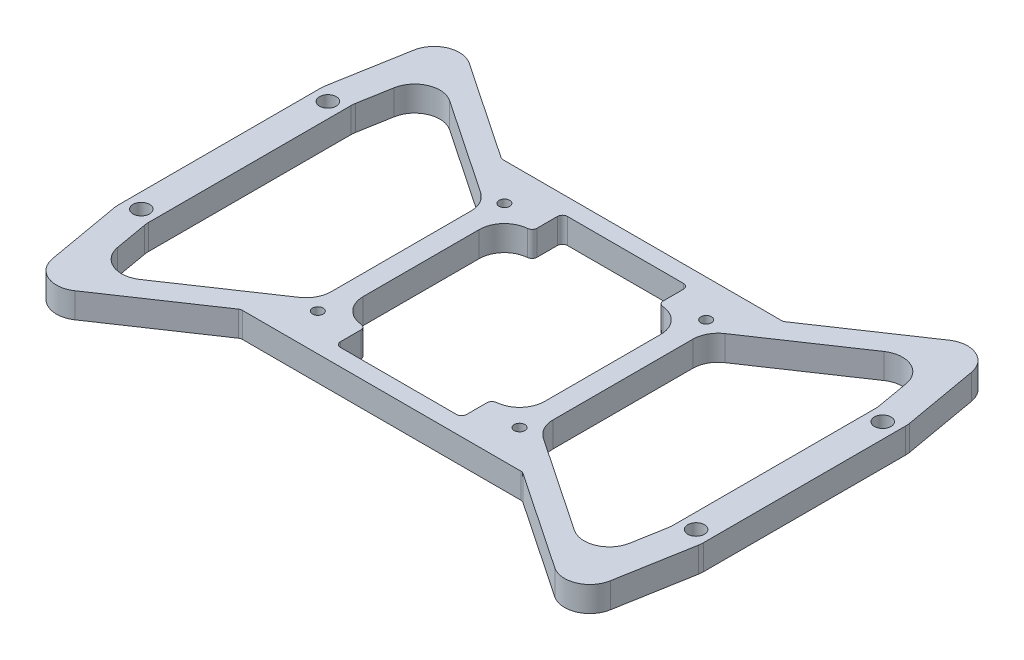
SolidWorks part; units mm, degrees
ref_plane "Front Plane" through (0, 0, 0) normal (0, 0, 1) x (1, 0, 0)
ref_plane "Top Plane" through (0, 0, 0) normal (0, 1, 0) x (1, 0, 0)
ref_plane "Right Plane" through (0, 0, 0) normal (1, 0, 0) x (0, 0, -1)
sketch "Sketch1" plane through (0, 0, 0) normal (0, 1, 0) x (1, 0, 0)
  line L0 (0, 18.5) -> (0, -18.5) construction
  line L1 (55, -18.5) -> (-55, -18.5) construction
  line L2 (55, -18.5) -> (55, 18.5) construction
  line L3 (55, 18.5) -> (-55, 18.5) construction
  line L4 (-55, -18.5) -> (-55, 18.5) construction
  line L5 (55, -18.5) -> (-55, 18.5) construction
  line L6 (55, 18.5) -> (-55, -18.5) construction
  line L26 (20, 18.5) -> (20, -18.5) construction
  line L42 (52, 20.5) -> (52, -20.5)
  line L43 (-58, 0) -> (58, 0) construction
  line L44 (-55, 0) -> (55, 0) construction
  line L45 (-55, 18.5) -> (-55, -18.5) construction
  line L46 (-58, 20.5) -> (-58, -20.5)
  line L47 (-49.4433, 35) -> (-52, 20.5)
  line L48 (-52, 20.5) -> (-52, -20.5)
  line L49 (-58, 20.5) -> (-58, 30.119) construction
  line L50 (-58, 20.5) -> (-53.963, 43.3951)
  line L51 (-53.963, 43.3951) -> (-20, 20.5)
  line L52 (-20, 20.5) -> (20, 20.5)
  line L53 (0, -55) -> (0, 55) construction
  line L54 (22, 16.5) -> (-22, 16.5)
  line L55 (-22, 16.5) -> (-49.4433, 35)
  line L56 (58, 20.5) -> (58, -20.5)
  line L57 (-22, 16.5) -> (-22, -16.5)
  line L58 (58, 20.5) -> (53.963, 43.3951)
  line L59 (49.4433, 35) -> (52, 20.5)
  line L60 (22, 16.5) -> (49.4433, 35)
  line L61 (53.963, 43.3951) -> (20, 20.5)
  line L62 (49.4433, -35) -> (52, -20.5)
  line L63 (58, -20.5) -> (53.963, -43.3951)
  line L64 (53.963, -43.3951) -> (20, -20.5)
  line L65 (22, -16.5) -> (49.4433, -35)
  line L66 (22, -16.5) -> (-22, -16.5)
  line L67 (-20, -20.5) -> (20, -20.5)
  line L68 (-53.963, -43.3951) -> (-20, -20.5)
  line L69 (-22, -16.5) -> (-49.4433, -35)
  line L70 (-49.4433, -35) -> (-52, -20.5)
  line L71 (-58, -20.5) -> (-53.963, -43.3951)
  line L72 (-18, 16.5) -> (-18, -16.5)
  line L73 (-20, 18.5) -> (-20, -18.5) construction
  line L74 (22, 16.5) -> (22, -16.5)
  line L75 (18, 16.5) -> (18, -16.5)
  circle A0 centre (-20, 18.5) radius 1.05
  circle A1 centre (20, 18.5) radius 1.05
  circle A2 centre (20, -18.5) radius 1.05
  circle A3 centre (-20, -18.5) radius 1.05
  circle A4 centre (-55, 18.5) radius 1.65
  circle A5 centre (-55, -18.5) radius 1.65
  circle A6 centre (55, -18.5) radius 1.65
  circle A7 centre (55, 18.5) radius 1.65
  point P0 (0, 0)
  point P16 (0, 0)
  point P47 (0, 20.5)
  point P53 (0, 16.5)
  point P60 (52, 0)
  point P69 (-52, 0)
  dimension "D4" = 2.1
  dimension "D6" = 3.3
  dimension "D1" = 37
  dimension "D2" = 35
  dimension "D3" = 40
  dimension "D5" = 4
  dimension "D7" = 110
  dimension "D8" = 6
  dimension "D9" = 10
  dimension "D10" = 4
extrude "Boss-Extrude1" add sketch "Sketch1" along normal blind 5 contours L72 L54 L57 L66 | L46 L71 L68 L67 L64 L63 L56 L58 L61 L52 L51 L50 A7 A6 A5 A4 A3 A2 A1 A0 L69 L70 L48 L47 L55 L54 L60 L59 L42 L62 L65 L66 | L54 L75 L66 L74
fillet "Fillet1" radius 5 28 edges at (-52, 2.5, 20.5) (-49.4433, 2.5, 35) (-52, 2.5, -20.5) (-49.4433, 2.5, -35) (-22, 2.5, -16.5) (-22, 2.5, 16.5) (22, 2.5, 16.5) (22, 2.5, -16.5) (49.4433, 2.5, -35) (52, 2.5, -20.5) (52, 2.5, 20.5) (49.4433, 2.5, 35) (-18, 2.5, -16.5) (18, 2.5, -16.5) (18, 2.5, 16.5) (-18, 2.5, 16.5) (-20, 2.5, 20.5) (20, 2.5, 20.5) (53.963, 2.5, 43.3951) (58, 2.5, 20.5) (58, 2.5, -20.5) (53.963, 2.5, -43.3951) (20, 2.5, -20.5) (-20, 2.5, -20.5) (-53.963, 2.5, -43.3951) (-58, 2.5, -20.5) (-58, 2.5, 20.5) (-53.963, 2.5, 43.3951)
sketch "Sketch3" plane through (0, 5, 0) normal (0, 1, 0) x (1, 0, 0)
  line L0 (-18.4721, -20.5) -> (18.4721, -20.5) construction
  line L1 (-27.9337, -20.5) -> (27.9337, -20.5)
  line L2 (-27.9337, -20.5) -> (-27.9337, -25.8482)
  line L3 (-27.9337, -25.8482) -> (27.9337, -25.8482)
  line L4 (27.9337, -20.5) -> (27.9337, -25.8482)
  line L5 (-24.2051, -17.9865) -> (-43.0609, -30.6976) construction
  line L6 (-47.5807, -39.0926) -> (-21.2669, -21.3541) construction
  line L7 (47.5807, -39.0926) -> (21.2669, -21.3541) construction
extrude "Boss-Extrude2" add sketch "Sketch3" against normal up to surface (5 mm away)
sketch "Sketch2" plane through (0, 5, 0) normal (0, 1, 0) x (1, 0, 0)
  line L0 (13, -16.5) -> (-13, -16.5) construction
  line L1 (-12.5, -16.5) -> (12.5, -16.5)
  line L2 (-12.5, -16.5) -> (-12.5, -22.5)
  line L3 (-12.5, -22.5) -> (12.5, -22.5)
  line L4 (12.5, -16.5) -> (12.5, -22.5)
  line L5 (0, -2.75) -> (0, 2.75) construction
  point P6 (0, -22.5)
  dimension "D1" = 25
  dimension "D2" = 6
extrude "Cut-Extrude1" cut sketch "Sketch2" against normal through all
fillet "Fillet2" radius 1 6 edges at (27.9337, 2.5, 25.8482) (-27.9337, 2.5, 25.8482) (-12.5, 2.5, 16.5) (-12.5, 2.5, 22.5) (12.5, 2.5, 22.5) (12.5, 2.5, 16.5)
mirror "Mirror1" about plane through (0, 0, 0) normal (0, 0, 1) of "Cut-Extrude1", "Boss-Extrude2"
fillet "Fillet3" radius 1 6 edges at (-27.9337, 2.5, -25.8482) (27.9337, 2.5, -25.8482) (12.5, 2.5, -22.5) (12.5, 2.5, -16.5) (-12.5, 2.5, -16.5) (-12.5, 2.5, -22.5)
